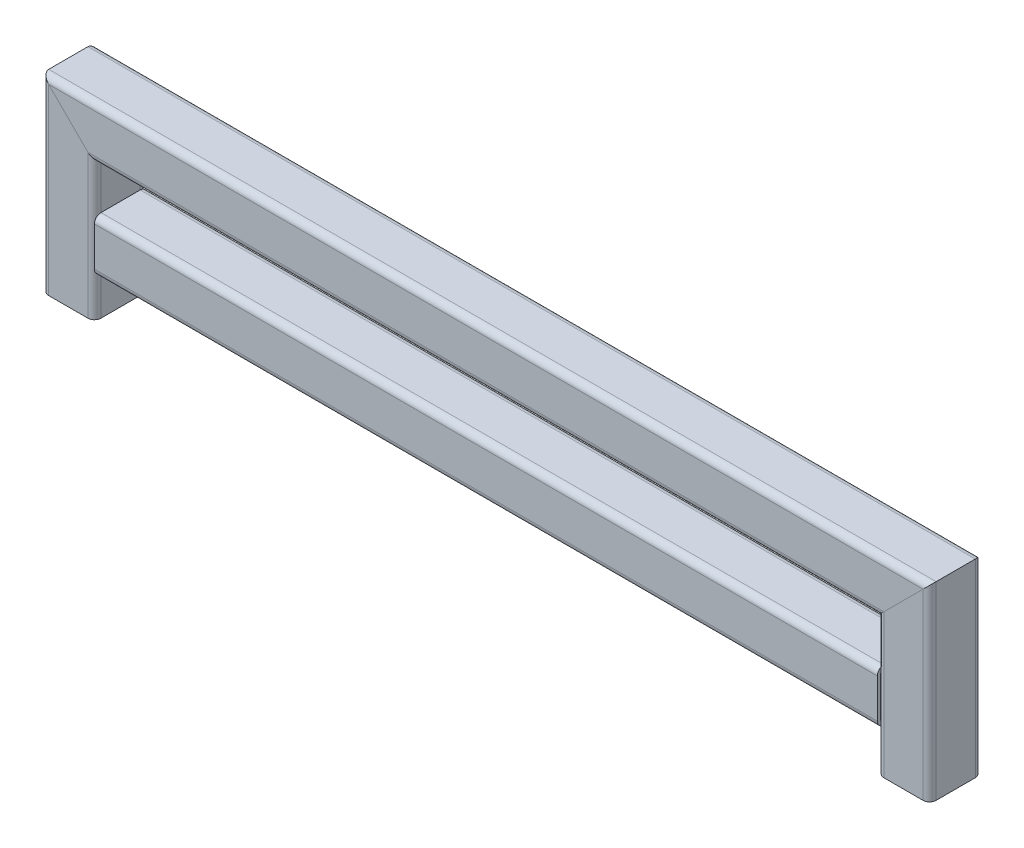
SolidWorks part; units mm, degrees
ref_plane "Plan de face" through (0, 0, 0) normal (0, 0, 1) x (1, 0, 0)
ref_plane "Plan de dessus" through (0, 0, 0) normal (0, 1, 0) x (1, 0, 0)
ref_plane "Plan de droite" through (0, 0, 0) normal (1, 0, 0) x (0, 0, -1)
sketch3d "Esquisse3D2"
  line L0 (0, 0, 0) -> (0, 250, 0)
  line L1 (0, 250, 0) -> (1278.5, 250, 0)
  line L2 (1278.5, 250, 0) -> (1278.5, 0, 0)
  line L3 (0, 100, 0) -> (1278.5, 100, 0)
  dimension "D1" = 250
  dimension "D2" = 250
  dimension "D3" = 1278.5
  dimension "D4" = 150
other "Elément mécano-soudé1"
ref_plane "Plan1" through (0, 0, 0) normal (0, 1, 0) x (-1, 0, 0)
sketch "Sketch1" plane through (0, 0, 0) normal (0, 1, 0) x (-1, 0, 0)
  line L0 (-30, -35) -> (30, -35)
  line L1 (-35, -30) -> (-35, 30)
  line L2 (30, 35) -> (-30, 35)
  line L3 (35, 30) -> (35, -30)
  line L4 (-30, -40) -> (30, -40)
  line L5 (-40, -30) -> (-40, 30)
  line L6 (30, 40) -> (-30, 40)
  line L7 (40, 30) -> (40, -30)
  arc A0 (40, 30) -> (30, 40) centre (30, 30) ccw
  arc A1 (30, -40) -> (40, -30) centre (30, -30) ccw
  arc A2 (-40, -30) -> (-30, -40) centre (-30, -30) ccw
  arc A3 (-30, 40) -> (-40, 30) centre (-30, 30) ccw
  arc A4 (-30, 35) -> (-35, 30) centre (-30, 30) ccw
  arc A5 (35, 30) -> (30, 35) centre (30, 30) ccw
  arc A6 (30, -35) -> (35, -30) centre (30, -30) ccw
  arc A7 (-35, -30) -> (-30, -35) centre (-30, -30) ccw
  point P0 (-40, 0)
  point P1 (40, 0)
  point P2 (0, 40)
  point P3 (0, -40)
  point P4 (0, 0)
  point P5 (-40, -40)
  point P6 (40, -40)
  point P7 (40, 40)
  point P8 (-40, 40)
  point P33 (0, 0)
  dimension "D1" = 10
  dimension "Thickness" = 5
  dimension "V_leg" = 80
